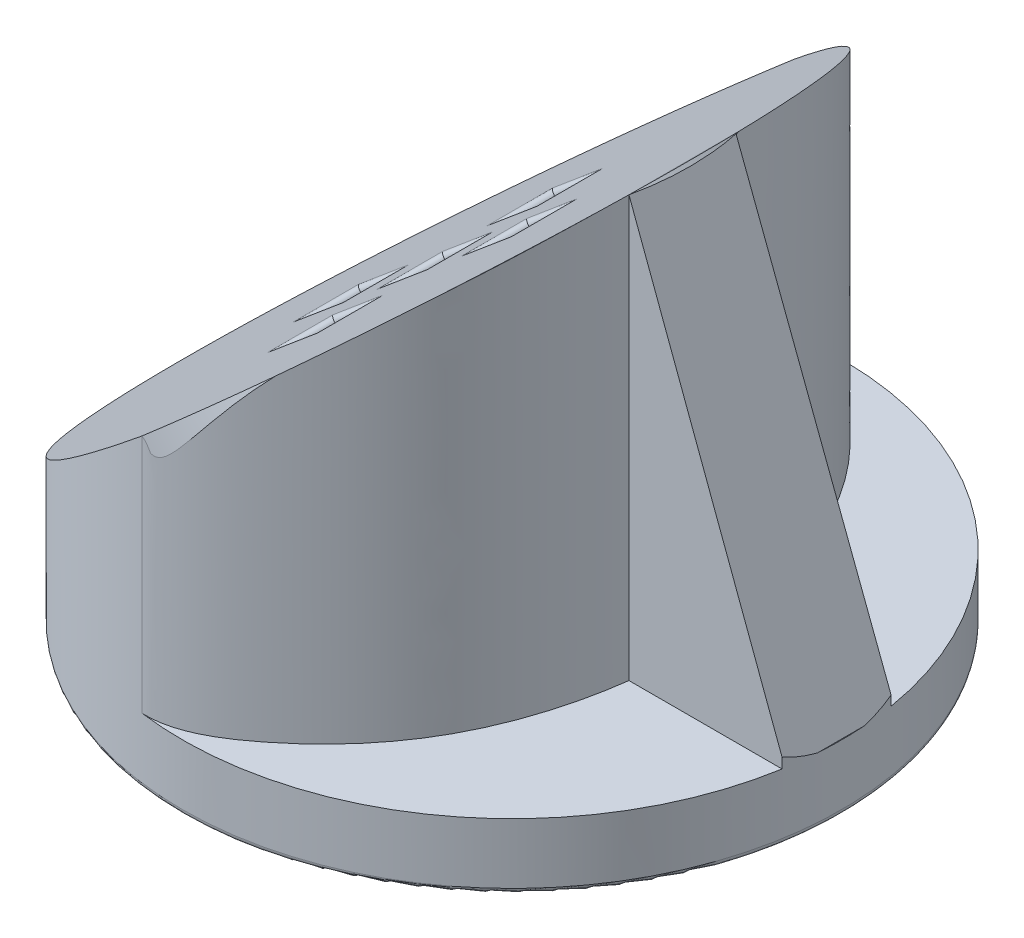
SolidWorks part; units mm, degrees
ref_plane "Front Plane" through (0, 0, 0) normal (0, 0, 1) x (1, 0, 0)
ref_plane "Top Plane" through (0, 0, 0) normal (0, 1, 0) x (1, 0, 0)
ref_plane "Right Plane" through (0, 0, 0) normal (1, 0, 0) x (0, 0, -1)
sketch "Sketch1" plane through (0, 0, 0) normal (0, 1, 0) x (1, 0, 0)
  circle A0 centre (0, 0) radius 30
extrude "Boss-Extrude1" add sketch "Sketch1" along normal blind 50
sketch "Sketch3" plane through (0, 50, 0) normal (0, 1, 0) x (1, 0, 0)
sketch "Sketch4" plane through (0, 0, 0) normal (0, -1, 0) x (-1, 0, 0)
  line L0 (0, 0) -> (-10, 0) construction
  line L1 (0, 0) -> (0, -10) construction
  line L2 (0, 0) -> (0, 10) construction
  line L3 (0, 0) -> (10, 0) construction
  line L5 (-2.5, 2.5) -> (2.5, 2.5)
  line L6 (-2.5, 2.5) -> (-2.5, -2.5)
  line L7 (-2.5, -2.5) -> (2.5, -2.5)
  line L8 (2.5, 2.5) -> (2.5, -2.5)
  line L9 (-2.5, 2.5) -> (2.5, -2.5) construction
  line L10 (-2.5, -2.5) -> (2.5, 2.5) construction
  line L11 (-2.5, -7.5) -> (2.5, -7.5)
  line L12 (-2.5, -7.5) -> (-2.5, -12.5)
  line L13 (-2.5, -12.5) -> (2.5, -12.5)
  line L14 (2.5, -7.5) -> (2.5, -12.5)
  line L15 (-2.5, -7.5) -> (2.5, -12.5) construction
  line L16 (-2.5, -12.5) -> (2.5, -7.5) construction
  line L17 (7.5, 2.5) -> (12.5, 2.5)
  line L18 (7.5, 2.5) -> (7.5, -2.5)
  line L19 (7.5, -2.5) -> (12.5, -2.5)
  line L20 (12.5, 2.5) -> (12.5, -2.5)
  line L21 (7.5, 2.5) -> (12.5, -2.5) construction
  line L22 (7.5, -2.5) -> (12.5, 2.5) construction
  line L23 (-12.5, 2.5) -> (-7.5, 2.5)
  line L24 (-12.5, 2.5) -> (-12.5, -2.5)
  line L25 (-12.5, -2.5) -> (-7.5, -2.5)
  line L26 (-7.5, 2.5) -> (-7.5, -2.5)
  line L27 (-12.5, 2.5) -> (-7.5, -2.5) construction
  line L28 (-12.5, -2.5) -> (-7.5, 2.5) construction
  line L29 (2.5, 7.5) -> (-2.5, 7.5)
  line L30 (2.5, 7.5) -> (2.5, 12.5)
  line L31 (2.5, 12.5) -> (-2.5, 12.5)
  line L32 (-2.5, 7.5) -> (-2.5, 12.5)
  line L33 (2.5, 7.5) -> (-2.5, 12.5) construction
  line L34 (2.5, 12.5) -> (-2.5, 7.5) construction
  dimension "D1" = 5
  dimension "D2" = 5
  dimension "D3" = 5
  dimension "D4" = 5
  dimension "D5" = 5
  dimension "D6" = 5
extrude "Cut-Extrude2" cut sketch "Sketch4" against normal blind 3
fillet "Fillet2" radius 0.5 21 edges at (0, 0, 30) (2.5, 0, 0) (0, 0, 2.5) (-2.5, 0, 0) (0, 0, -2.5) (2.5, 0, 10) (0, 0, 12.5) (-2.5, 0, 10) (0, 0, 7.5) (-7.5, 0, 0) (-10, 0, 2.5) (-12.5, 0, 0) (-10, 0, -2.5) (12.5, 0, 0) (10, 0, 2.5) (7.5, 0, 0) (10, 0, -2.5) (-2.5, 0, -10) (0, 0, -12.5) (2.5, 0, -10) (0, 0, -7.5)
ref_plane "Plane6" through (0, 0, 3.5) normal (0, 0, 1) x (1, 0, 0)
sketch "Sketch13" plane through (0, 0, 3.5) normal (0, 0, 1) x (1, 0, 0)
  line L0 (-30, 6) -> (22.4372, 50)
  line L1 (-30, 50) -> (-30, 0.5) construction
  line L4 (22.4372, 50) -> (-30, 50)
  line L5 (-30, 50) -> (-30, 6)
  line L6 (30, 0.5) -> (-30, 0.5) construction
  dimension "D1" = 5.5
  dimension "D2" = 40
extrude "Cut-Extrude10" cut sketch "Sketch13" against normal mid plane 90
ref_plane "Plane4" through (0, 0, -2.5) normal (0, 0, -1) x (-1, 0, 0)
ref_plane "Plane5" through (0, 0, -62.5) normal (0, 0, -1) x (-1, 0, 0)
sketch "Sketch15" plane through (-15.3497, 18.2931, 0) normal (-0.6428, 0.766, 0) x (0.766, 0.6428, 0)
  line L0 (-19.1246, 0) -> (0, 0) construction
  line L2 (3.3754, -2.5) -> (-1.6246, -2.5)
  line L3 (3.3754, -2.5) -> (3.3754, 2.5)
  line L4 (3.3754, 2.5) -> (-1.6246, 2.5)
  line L5 (-1.6246, -2.5) -> (-1.6246, 2.5)
  line L6 (3.3754, -2.5) -> (-1.6246, 2.5) construction
  line L7 (3.3754, 2.5) -> (-1.6246, -2.5) construction
  line L8 (13.3754, -2.5) -> (8.3754, -2.5)
  line L9 (13.3754, -2.5) -> (13.3754, 2.5)
  line L10 (13.3754, 2.5) -> (8.3754, 2.5)
  line L11 (8.3754, -2.5) -> (8.3754, 2.5)
  line L12 (13.3754, -2.5) -> (8.3754, 2.5) construction
  line L13 (13.3754, 2.5) -> (8.3754, -2.5) construction
  line L14 (23.3754, -2.5) -> (18.3754, -2.5)
  line L15 (23.3754, -2.5) -> (23.3754, 2.5)
  line L16 (23.3754, 2.5) -> (18.3754, 2.5)
  line L17 (18.3754, -2.5) -> (18.3754, 2.5)
  line L18 (23.3754, -2.5) -> (18.3754, 2.5) construction
  line L19 (23.3754, 2.5) -> (18.3754, -2.5) construction
  line L20 (13.3754, -12.5) -> (8.3754, -12.5)
  line L21 (13.3754, -12.5) -> (13.3754, -7.5)
  line L22 (13.3754, -7.5) -> (8.3754, -7.5)
  line L23 (8.3754, -12.5) -> (8.3754, -7.5)
  line L24 (13.3754, -12.5) -> (8.3754, -7.5) construction
  line L25 (13.3754, -7.5) -> (8.3754, -12.5) construction
  line L26 (13.3754, 7.5) -> (8.3754, 7.5)
  line L27 (13.3754, 7.5) -> (13.3754, 12.5)
  line L28 (13.3754, 12.5) -> (8.3754, 12.5)
  line L29 (8.3754, 7.5) -> (8.3754, 12.5)
  line L30 (13.3754, 7.5) -> (8.3754, 12.5) construction
  line L31 (13.3754, 12.5) -> (8.3754, 7.5) construction
  ellipse E0 centre (20.0376, 0) end of major axis (-19.1246, 0) minor radius 30 construction
  point P9 (0.8754, 0)
  point P14 (10.8754, 0)
  point P19 (20.8754, 0)
  point P24 (10.8754, -10)
  point P29 (10.8754, 10)
  dimension "D1" = 40
  dimension "D2" = 30
  dimension "D3" = 20
  dimension "D4" = 5
  dimension "D5" = 5
  dimension "D6" = 5
  dimension "D7" = 5
  dimension "D8" = 5
  dimension "D9" = 5
  dimension "D10" = 5
  dimension "D11" = 5
  dimension "D12" = 10
  dimension "D13" = 10
  dimension "D14" = 5
  dimension "D15" = 5
extrude "Cut-Extrude11" cut sketch "Sketch15" against normal blind 3
ref_plane "Plane7" through (0, 0, 0) normal (0, 0, -1) x (-1, 0, 0)
sketch "Sketch24" plane through (-15.3497, 18.2931, 0) normal (-0.6428, 0.766, 0) x (0.766, 0.6428, 0)
  line L0 (10.8754, -30) -> (8.2869, -61.3494)
  line L1 (10.8754, 0) -> (-19.1246, 0)
  line L3 (8.2869, -61.3494) -> (91.449, -58.1784)
  line L4 (91.449, -58.1784) -> (76.5573, 58.2179)
  line L5 (76.5573, 58.2179) -> (10.8754, 46.8115)
  line L6 (10.8754, 46.8115) -> (10.8754, 30)
  arc A0 (10.8754, -30) -> (-19.1246, 0) centre (10.8754, 0) ccw
  ellipse E1 centre (20.0376, 0) end of major axis (-19.1246, 0) minor radius 30 construction
  dimension "D1" = 30
extrude "Cut-Extrude13" cut sketch "Sketch24" against normal blind 100 contours A0 M21
fillet "Fillet8" radius 0.5 4 edges at (-7.0187, 25.2836, -7.5) (-5.1036, 26.8906, -10) (-7.0187, 25.2836, -12.5) (-8.9338, 23.6767, -10)
fillet "Fillet9" radius 0.5 4 edges at (0.6418, 31.7115, 2.5) (2.5569, 33.3185, 0) (0.6418, 31.7115, -2.5) (-1.2733, 30.1045, 0)
fillet "Fillet10" radius 0.5 4 edges at (-16.5942, 17.2488, 0) (-14.6791, 18.8558, 2.5) (-12.764, 20.4627, 0) (-14.6791, 18.8558, -2.5)
fillet "Fillet11" radius 0.5 4 edges at (-8.9338, 23.6767, 10) (-7.0187, 25.2836, 12.5) (-5.1036, 26.8906, 10) (-7.0187, 25.2836, 7.5)
fillet "Fillet12" radius 0.5 4 edges at (-8.9338, 23.6767, 0) (-7.0187, 25.2836, 2.5) (-5.1036, 26.8906, 0) (-7.0187, 25.2836, -2.5)
sketch "Sketch26" plane through (0, 0, 3.5) normal (0, 0, 1) x (1, 0, 0)
  line L1 (21.1305, 54.6487) -> (36.0272, 54.6487)
  line L2 (21.1305, 54.6487) -> (21.1305, 40.5617)
  line L3 (21.1305, 40.5617) -> (36.0272, 40.5617)
  line L4 (36.0272, 54.6487) -> (36.0272, 40.5617)
  line L5 (21.1305, 54.6487) -> (36.0272, 40.5617) construction
  line L6 (21.1305, 40.5617) -> (36.0272, 54.6487) construction
  point P0 (28.5788, 47.6052)
extrude "Cut-Extrude14" cut sketch "Sketch26" against normal mid plane 100
ref_plane "Plane8" through (0, 6, 0) normal (0, -1, 0) x (-1, 0, 0)
sketch "Sketch27" plane through (0, 6, 0) normal (0, -1, 0) x (-1, 0, 0)
  line L0 (3.9742, 45.0824) -> (-36.6651, 45.0824)
  line L1 (-36.6651, 45.0824) -> (-36.6651, 5)
  line L2 (5.284, -29.531) -> (5.284, -31.7153)
  line L3 (5.284, -31.7153) -> (-36.6651, -31.7153)
  line L4 (-36.6651, -31.7153) -> (-36.6651, -5)
  line L5 (0, 0) -> (-38.9158, 0) construction
  line L6 (26.5363, 0) -> (-26.5363, 0) construction
  line L7 (-36.6651, -5) -> (-15.6405, -5)
  line L8 (-36.6651, 5) -> (-15.6753, 4.7297)
  line L9 (3.9742, 45.0824) -> (3.9742, 29.7356)
  arc A0 (3.9742, -29.7356) -> (3.9742, 29.7356) centre (0, 0) ccw construction
  ellipse E0 centre (7.0187, 0) end of major axis (7.0187, -30) minor radius 22.9813 (3.9742, 29.7356) -> (3.9742, -29.7356) ccw construction
  spline S0 degree 3 poles (3.9742, 29.7356) (-0.6362, 28.9418) (-7.7581, 24.3839) (-13.6551, 14.4645) (-15.2896, 7.8837) (-15.6753, 4.7297) knots 0 0 0 0 0.174844 0.310363 0.43177 0.43177 0.43177 0.43177
  spline S1 degree 3 poles (-15.6405, -5) (-15.5553, -5.6578) (-14.8672, -10.0808) (-12.2122, -17.9633) (-5.1405, -26.1873) (1.7947, -30.4354) (5.284, -29.531) knots 0.555853 0.555853 0.555853 0.555853 0.581074 0.725808 0.865335 1 1 1 1
  dimension "D1" = 5
  dimension "D2" = 5
extrude "Cut-Extrude15" cut sketch "Sketch27" against normal blind 40
sketch "Sketch28" plane through (0, 0, 5) normal (0, 0, 1) x (1, 0, 0)
  line L0 (15.6412, 44.2975) -> (31.0465, 44.2975)
  line L1 (31.0465, 44.2975) -> (31.0465, 6)
  line L2 (-32.45, 6) -> (32.45, 6) construction
  line L3 (31.0465, 6) -> (29.9251, 6)
  line L4 (29.9251, 6) -> (15.6412, 44.2975)
extrude "Cut-Extrude16" cut sketch "Sketch28" against normal blind 40
sketch "Sketch29" plane through (0, 6, 0) normal (0, 1, 0) x (1, 0, 0)
  text T0 "<b>40</b>"
